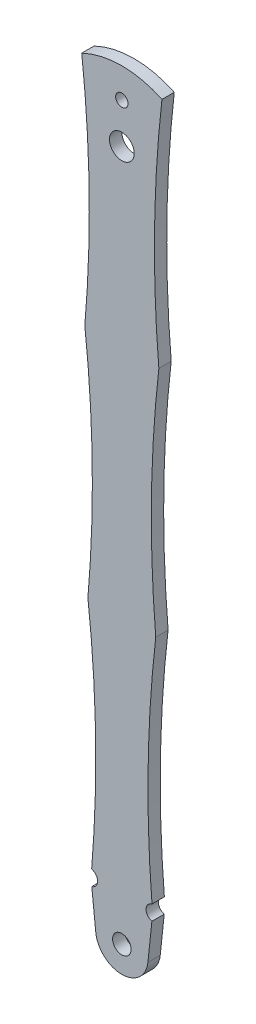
SolidWorks part; units mm, degrees
ref_plane "Front Plane" through (0, 0, 0) normal (0, 0, 1) x (1, 0, 0)
ref_plane "Top Plane" through (0, 0, 0) normal (0, 1, 0) x (1, 0, 0)
ref_plane "Right Plane" through (0, 0, 0) normal (1, 0, 0) x (0, 0, -1)
sketch "Sketch1" plane through (0, 0, 0) normal (0, 0, 1) x (1, 0, 0)
  line L0 (-10.89, 3.0876) -> (-10.89, 126.0876)
  line L1 (0, 0) -> (0, -27.3106)
  line L2 (-17.39, 124.942) -> (-4.39, 124.942)
  line L3 (-16.89, 86.942) -> (-4.89, 86.942)
  line L4 (-16.39, 48.942) -> (-5.39, 48.942)
  line L5 (-15.89, 9.942) -> (-5.89, 9.942)
  line L6 (-15.89, 9.942) -> (-15.1164, 2.6398)
  line L7 (-5.89, 9.942) -> (-6.6637, 2.6398)
  circle A1 centre (-10.89, 3.0876) radius 1.5
  circle A2 centre (-10.89, 3.0876) radius 4.25
  arc A3 (-4.39, 124.942) -> (-17.39, 124.942) centre (-10.89, 111.4235) ccw
  arc A4 (-17.39, 124.942) -> (-16.89, 86.942) centre (-206.1711, 103.4548) cw
  arc A5 (-16.89, 86.942) -> (-16.39, 48.942) centre (-205.6711, 65.4548) cw
  arc A6 (-16.39, 48.942) -> (-15.89, 9.942) centre (-205.121, 27.0192) cw
  arc A7 (-4.39, 124.942) -> (-4.89, 86.942) centre (184.391, 103.4548) ccw
  arc A8 (-4.89, 86.942) -> (-5.39, 48.942) centre (183.891, 65.4548) ccw
  arc A9 (-5.39, 48.942) -> (-5.89, 9.942) centre (183.341, 27.0192) ccw
extrude "Boss-Extrude1" add sketch "Sketch1" along normal blind 2
sketch "Sketch2" plane through (0, 0, 2) normal (0, 0, 1) x (1, 0, 0)
  line L0 (-5.7144, 9.9559) -> (-10.89, 3.0876)
  line L1 (-16.0656, 9.9559) -> (-10.89, 3.0876)
  line L2 (-10.89, 3.0876) -> (-10.89, -1.1624)
  circle A0 centre (-5.7144, 9.9559) radius 1.25
  circle A1 centre (-10.89, 3.0876) radius 8.6
  circle A2 centre (-16.0656, 9.9559) radius 1.25
  arc A4 (-15.1164, 2.6398) -> (-6.6637, 2.6398) centre (-10.89, 3.0876) ccw construction
extrude "Cut-Extrude1" cut sketch "Sketch2" against normal through all contours A2 | A0
sketch "Sketch3" plane through (0, 0, 2) normal (0, 0, 1) x (1, 0, 0)
  line L0 (-10.89, 3.0876) -> (-10.89, -1.1624)
  circle A0 centre (-10.89, 115.0876) radius 2
  arc A1 (-15.1164, 2.6398) -> (-6.6637, 2.6398) centre (-10.89, 3.0876) ccw construction
  circle A2 centre (-10.89, 3.0876) radius 1.5 construction
  dimension "D1" = 4
  dimension "D2" = 112
extrude "Cut-Extrude2" cut sketch "Sketch3" against normal up to next contours A0
sketch "Sketch4" plane through (0, 0, 2) normal (0, 0, 1) x (1, 0, 0)
  line L0 (-10.89, 115.0876) -> (-10.89, 3.0876)
  circle A0 centre (-10.89, 121.5876) radius 1
  dimension "D2" = 2
  dimension "D1" = 6.5
extrude "Cut-Extrude3" cut sketch "Sketch4" against normal through all contours A0
equation "\"D20@Sketch1\"=\"D17@Sketch1\""
equation "\"D16@Sketch1\"=\"D17@Sketch1\""
equation "\"D15@Sketch1\"=\"D17@Sketch1\""
equation "\"D18@Sketch1\"=\"D17@Sketch1\""
equation "\"D19@Sketch1\"=\"D17@Sketch1\""
equation "\"D5@Sketch2\"=\"D2@Sketch2\""
equation "\"D4@Sketch2\"=\"D3@Sketch2\""
